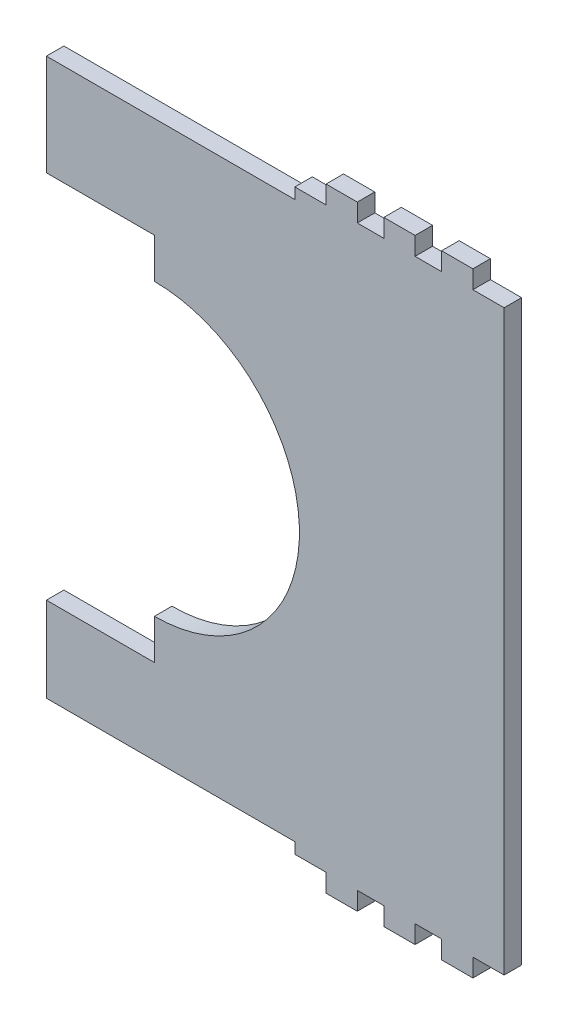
SolidWorks part; units mm, degrees
ref_plane "Alzado" through (0, 0, 0) normal (0, 0, 1) x (1, 0, 0)
ref_plane "Planta" through (0, 0, 0) normal (0, 1, 0) x (1, 0, 0)
ref_plane "Vista lateral" through (0, 0, 0) normal (1, 0, 0) x (0, 0, -1)
sketch "Croquis1" plane through (0, 0, 0) normal (0, 0, 1) x (1, 0, 0)
  line L0 (0, 0) -> (10, 0)
  line L1 (10, 0) -> (10, -5.8)
  line L2 (10, -5.8) -> (20, -5.8)
  line L3 (20, -5.8) -> (20, 0)
  line L4 (20, 0) -> (28.5, 0)
  line L5 (28.5, 0) -> (28.5, -5.8)
  line L6 (28.5, -5.8) -> (38.5, -5.8)
  line L7 (38.5, -5.8) -> (38.5, 0)
  line L8 (38.5, 0) -> (47, 0)
  line L9 (47, 0) -> (47, -5.8)
  line L10 (47, -5.8) -> (57, -5.8)
  line L11 (57, -5.8) -> (57, 0)
  line L12 (57, 0) -> (67, 0)
  line L13 (67, 0) -> (67, 185)
  line L14 (67, 185) -> (57, 185)
  line L15 (57, 185) -> (57, 190.8)
  line L16 (57, 190.8) -> (47, 190.8)
  line L17 (47, 190.8) -> (47, 185)
  line L18 (47, 185) -> (38.5, 185)
  line L19 (38.5, 185) -> (38.5, 190.8)
  line L20 (38.5, 190.8) -> (28.5, 190.8)
  line L21 (28.5, 190.8) -> (28.5, 185)
  line L22 (28.5, 185) -> (20, 185)
  line L23 (20, 185) -> (20, 190.8)
  line L24 (20, 190.8) -> (10, 190.8)
  line L25 (10, 190.8) -> (10, 185)
  line L26 (10, 185) -> (0, 185)
  line L27 (0, 185) -> (0, 181.5)
  line L28 (0, 3.5) -> (-33.5679, 3.5)
  line L29 (-44.9397, 30.6918) -> (-44.9397, 43.4969)
  line L31 (-44.9397, 30.6918) -> (-79.5174, 30.6918)
  line L33 (0, 3.5) -> (0, 0)
  line L35 (-44.9397, 149.1418) -> (-44.9397, 136.3366)
  line L36 (0, 181.5) -> (-31.6739, 181.5)
  line L38 (-33.5679, 3.5) -> (-79.5174, 3.5)
  line L39 (-79.5174, 3.5) -> (-79.5174, 30.6918)
  line L40 (-44.9397, 149.1418) -> (-79.5174, 149.1418)
  line L41 (-79.5174, 181.5) -> (-79.5174, 149.1418)
  line L42 (-31.6739, 181.5) -> (-79.5174, 181.5)
  line L43 (-49.2062, 43.4969) -> (-35.767, 43.4969) construction
  arc A0 (-44.9397, 43.4969) -> (-44.9397, 136.3366) centre (-44.9397, 89.9168) ccw
  dimension "D1" = 185
  dimension "D2" = 5.8
  dimension "D3" = 10
  dimension "D4" = 67
  dimension "D5" = 10
  dimension "D6" = 10
  dimension "D7" = 8.5
  dimension "D8" = 8.5
  dimension "D9" = 8.5
  dimension "D10" = 8.5
  dimension "D11" = 10
  dimension "D12" = 10
  dimension "D13" = 3.5
  dimension "D14" = 3.5
extrude "Saliente-Extruir1" add sketch "Croquis1" along normal blind 5.6
